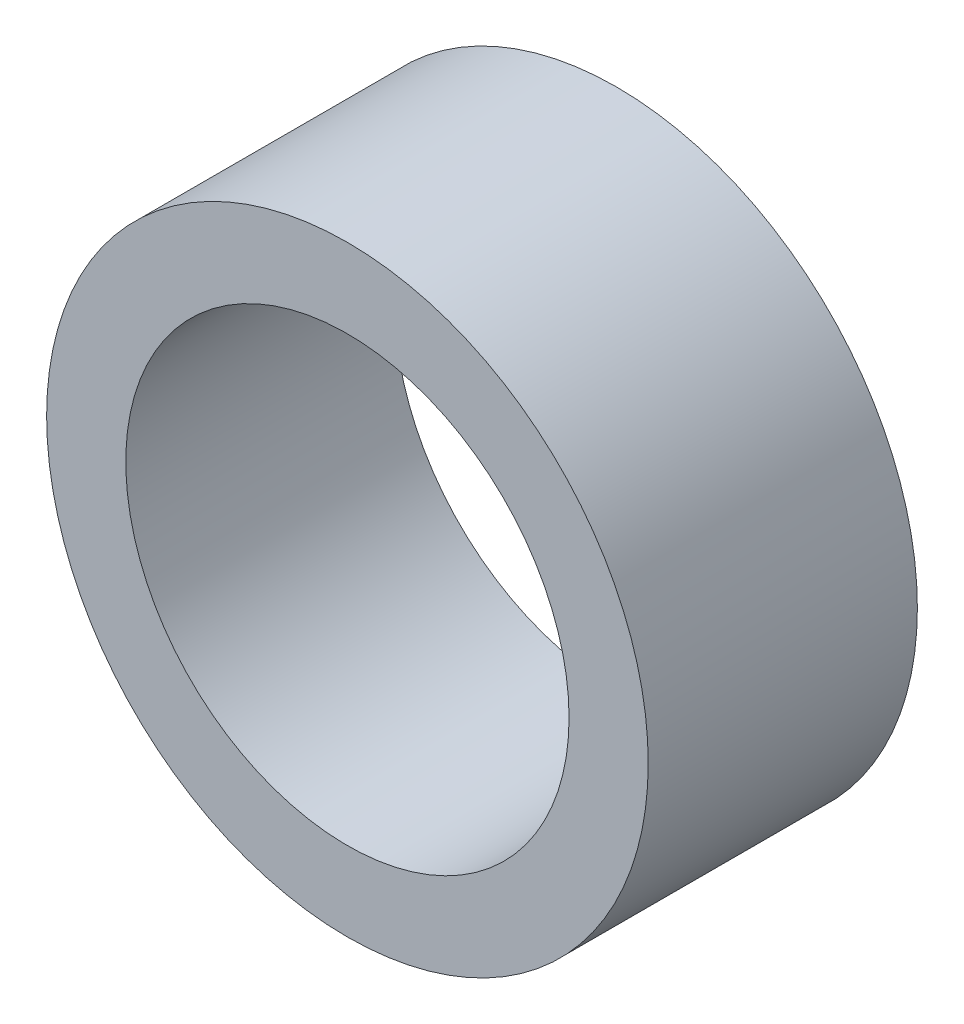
SolidWorks part; units mm, degrees
ref_plane "Спереди" through (0, 0, 0) normal (0, 0, 1) x (1, 0, 0)
ref_plane "Сверху" through (0, 0, 0) normal (0, 1, 0) x (1, 0, 0)
ref_plane "Справа" through (0, 0, 0) normal (1, 0, 0) x (0, 0, -1)
sketch "Sketch1" plane through (0, 0, 0) normal (0, 0, 1) x (1, 0, 0)
  circle A0 centre (0, 0) radius 19
  circle A1 centre (0, 0) radius 14
  dimension "D1" = 28
  dimension "D2" = 5
extrude "Extrude1" add sketch "Sketch1" along normal blind 17
